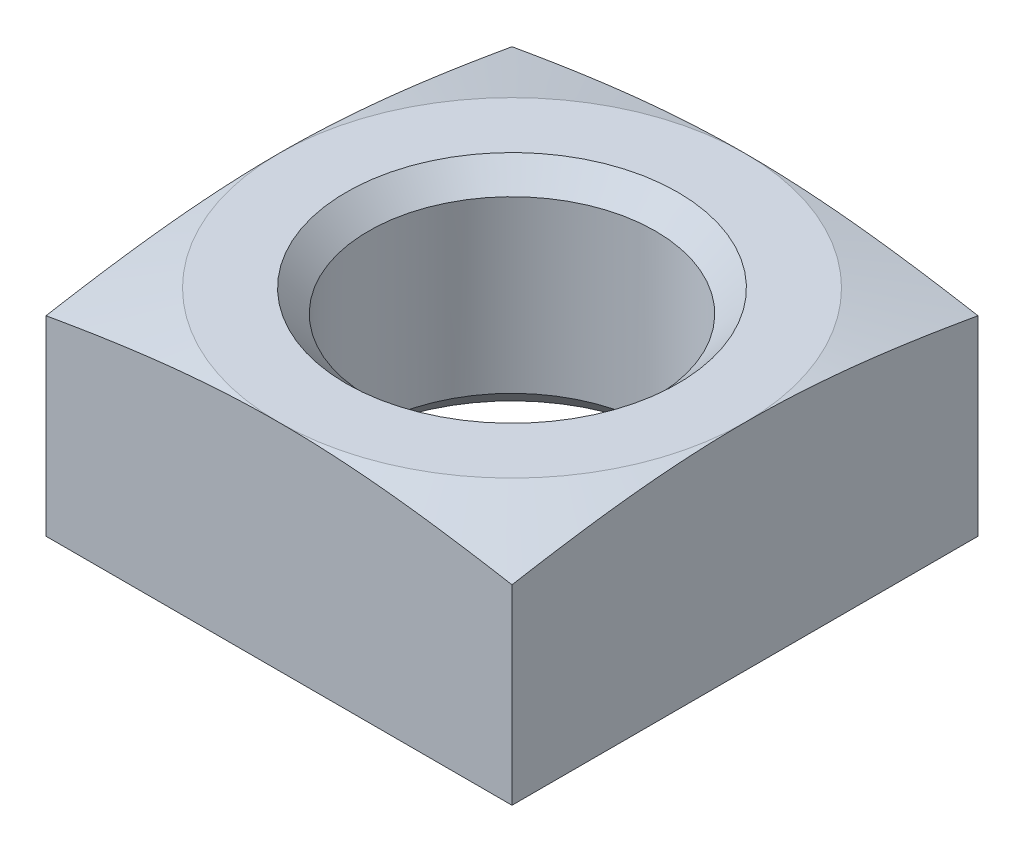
SolidWorks part; units mm, degrees
ref_plane "Front Plane" through (0, 0, 0) normal (0, 0, 1) x (1, 0, 0)
ref_plane "Top Plane" through (0, 0, 0) normal (0, 1, 0) x (1, 0, 0)
ref_plane "Right Plane" through (0, 0, 0) normal (1, 0, 0) x (0, 0, -1)
sketch "Sketch6" plane through (0, 0, 0) normal (1, 0, 0) x (0, 0, -1)
  line L0 (0, 59.8384) -> (0, -60.7908) construction
sketch "Sketch8" plane through (0, 0, 0) normal (1, 0, 0) x (0, 0, -1)
  line L1 (6.5, 3) -> (-6.5, 3)
  line L2 (6.5, 3) -> (6.5, -3)
  line L3 (6.5, -3) -> (-6.5, -3)
  line L4 (-6.5, 3) -> (-6.5, -3)
  line L5 (6.5, 3) -> (-6.5, -3) construction
  line L6 (6.5, -3) -> (-6.5, 3) construction
  point P0 (0, 0)
  dimension "D1" = 6
  dimension "D2" = 13
extrude "Boss-Extrude2" add sketch "Sketch8" along normal mid plane 13
sketch "Sketch10" plane through (0, 0, 0) normal (1, 0, 0) x (0, 0, -1)
  line L0 (-6.5, 3) -> (-9.3, 3)
  line L1 (-9.3, 3) -> (-9.3, 2.3)
  line L2 (-9.3, 2.3) -> (-6.5, 3)
  point P0 (-6.5, 3)
  point P6 (-6.5, 3)
  dimension "D1" = 0.7
  dimension "D2" = 2.8
revolve "Cut-Revolve1" cut sketch "Sketch10" angle 360 about L0
sketch "Sketch11" plane through (0, 3, 0) normal (0, 1, 0) x (1, 0, 0)
  circle A0 centre (0, 0) radius 4
  dimension "D1" = 8
extrude "Cut-Extrude1" cut sketch "Sketch11" against normal up to surface (6 mm away)
chamfer "Chamfer1" distance 0.625 angle 45 2 edges at (0, 3, 4) (0, -3, 4)
